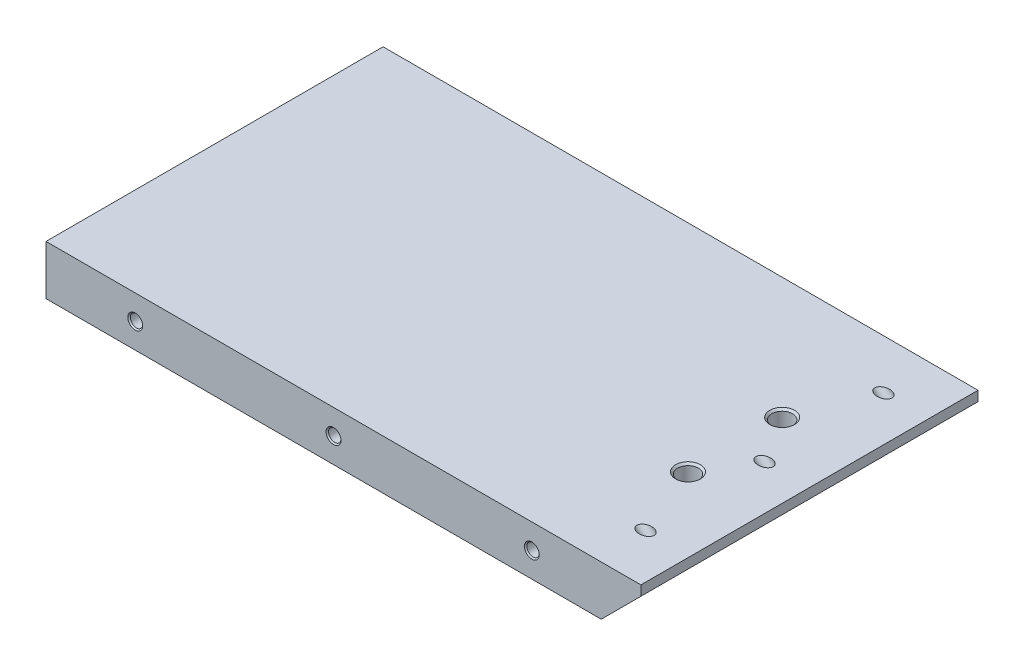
SolidWorks part; units mm, degrees
ref_plane "Face" through (0, 0, 0) normal (0, 0, 1) x (1, 0, 0)
ref_plane "Dessus" through (0, 0, 0) normal (0, 1, 0) x (1, 0, 0)
ref_plane "Profil" through (0, 0, 0) normal (1, 0, 0) x (0, 0, -1)
sketch "Esquisse1" plane through (0, 0, 0) normal (0, 0, 1) x (1, 0, 0)
  line L1 (0, -5) -> (120, -5)
  line L2 (0, -5) -> (0, 5)
  line L3 (0, 5) -> (120, 5)
  line L4 (120, -5) -> (120, 5)
  point P4 (0, 0)
  dimension "D1" = 120
  dimension "D2" = 10
extrude "Extrusion1" add sketch "Esquisse1" along normal mid plane 68
chamfer "Chanfrein1" distance 8 angle 45 1 edges at (120, -5, 0)
hole_wizard "Trou taraudé M5x0.81" positions "Esquisse3" profile "Esquisse2" tap size "M5x0.8" standard "ISO"
sketch "Esquisse3" plane through (0, 0, 0) normal (-1, 0, 0) x (0, 0, 1)
  line L0 (50, 0) -> (-50, 0) construction
  point P0 (-29, 0)
  dimension "D1" = 29
sketch "Esquisse2" plane through (0, 0, -29) normal (0, 1, 0) x (0, 0, 1)
  line L0 (0, 0) -> (0, 16.2618)
  line L1 (0, 16.2618) -> (2.1, 15)
  line L2 (2.1, 15) -> (2.1, 0.4)
  line L3 (2.1, 0.4) -> (2.5, 0)
  line L5 (2.5, 0) -> (0, 0)
  line L6 (-2.1, 0.4) -> (-2.5, 0) construction
  line L10 (0, 16.2618) -> (-2.1, 15) construction
  line L11 (0, -6.35) -> (0, 107.95) construction
  dimension "Diamètre du trou pour taraudage" = 4.2
  dimension "Profondeur du trou pour taraudage" = 15
  dimension "Diamètre du fraisage entrant" = 5
  dimension "Angle du fraisage entrant" = 90
  dimension "Angle de pointe" = 118
pattern_linear "Répétition linéaire1" count 2 spacing 58 along (0, 0, 1) of "Trou taraudé M5x0.81"
hole_wizard "Diamètre du perçage M5.0 (5.000000)1" positions "Esquisse5" profile "Esquisse6" hole size "M5.0" standard "ISO"
sketch "Esquisse5" plane through (0, 0, 0) normal (-1, 0, 0) x (0, 0, 1)
  line L0 (50, 0) -> (-50, 0) construction
  point P0 (-22.5, 0)
  dimension "D1" = 22.5
sketch "Esquisse6" plane through (0, 0, -22.5) normal (0, 1, 0) x (0, 0, 1)
  line L0 (0, 0) -> (0, 13.5022)
  line L1 (0, 13.5022) -> (2.5, 12)
  line L2 (2.5, 12) -> (2.5, 0.5)
  line L3 (2.5, 0.5) -> (3, 0)
  line L5 (3, 0) -> (0, 0)
  line L6 (-2.5, 0.5) -> (-3, 0) construction
  line L10 (0, 13.5022) -> (-2.5, 12) construction
  line L11 (0, -6.35) -> (0, 107.95) construction
  dimension "Diamètre du perçage" = 5
  dimension "Profondeur du perçage" = 12
  dimension "Diamètre du fraisage entrant" = 6
  dimension "Angle du fraisage entrant" = 90
  dimension "Angle de pointe" = 118
pattern_linear "Répétition linéaire2" count 2 spacing 45 along (0, 0, 1) of "Diamètre du perçage M5.0 (5.000000)1"
hole_wizard "Trou taraudé M5x0.82" positions "Esquisse3D1" profile "Esquisse7" tap size "M5x0.8" standard "ISO"
sketch3d "Esquisse3D1"
  point P0 (105, 5, 9.5)
  dimension "D1" = 9.5
  dimension "D2" = 105
sketch "Esquisse7" plane through (105, 5, 9.5) normal (1, 0, 0) x (0, 0, 1)
  line L0 (0, 0) -> (0, 10)
  line L1 (0, 10) -> (2.1, 10)
  line L2 (2.1, 10) -> (2.1, 0.4)
  line L3 (2.1, 0.4) -> (2.5, 0)
  line L5 (2.5, 0) -> (0, 0)
  line L6 (-2.1, 0.4) -> (-2.5, 0) construction
  line L11 (0, -6.35) -> (0, 107.95) construction
  dimension "Diamètre du trou pour taraudage jusqu'au prochain" = 4.2
  dimension "Profondeur du trou pour taraudage jusqu'au prochain" = 10
  dimension "Diamètre du fraisage entrant" = 5
  dimension "Angle du fraisage entrant" = 90
pattern_linear "Répétition linéaire3" count 2 spacing 19 along (0, 0, -1) of "Trou taraudé M5x0.82"
hole_wizard "Trou taraudé M3x0.51" positions "Esquisse9" profile "Esquisse8" tap size "M3x0.5" standard "ISO"
sketch "Esquisse9" plane through (58.5, -58.5, 0) normal (0.7071, -0.7071, 0) x (0.7071, 0.7071, 0)
  line L0 (75.6604, 34) -> (86.9741, 34) construction
  line L1 (86.9741, 34) -> (86.9741, -34) construction
  point P0 (81.9741, 24)
  dimension "D1" = 10
  dimension "D2" = 5
sketch "Esquisse8" plane through (116.4645, -0.5355, 24) normal (0, 0, 1) x (0.7071, 0.7071, 0)
  line L0 (0, 0) -> (0, 86.267)
  line L1 (0, 86.267) -> (1.25, 86.267)
  line L2 (1.25, 86.267) -> (1.25, 0.75)
  line L3 (1.25, 0.75) -> (2, 0)
  line L5 (2, 0) -> (0, 0)
  line L6 (-1.25, 0.75) -> (-2, 0) construction
  line L11 (0, -6.35) -> (0, 107.95) construction
  dimension "Diamètre du trou pour taraudage jusqu'au prochain" = 2.5
  dimension "Profondeur du trou pour taraudage jusqu'au prochain" = 86.267
  dimension "Diamètre du fraisage entrant" = 4
  dimension "Angle du fraisage entrant" = 90
pattern_linear "Répétition linéaire4" count 3 spacing 24 along (0, 0, -1) of "Trou taraudé M3x0.51"
hole_wizard "Trou taraudé M3x0.52" positions "Esquisse3D2" profile "Esquisse10" tap size "M3x0.5" standard "ISO"
sketch3d "Esquisse3D2"
  line L0 (0, 5, 34) -> (0, -5, 34) construction
  point P0 (18, 0, 34)
  dimension "D1" = 18
sketch "Esquisse10" plane through (18, 0, 34) normal (1, 0, 0) x (0, -1, 0)
  line L0 (0, 0) -> (0, 10.7511)
  line L1 (0, 10.7511) -> (1.25, 10)
  line L2 (1.25, 10) -> (1.25, 0.25)
  line L3 (1.25, 0.25) -> (1.5, 0)
  line L5 (1.5, 0) -> (0, 0)
  line L6 (-1.25, 0.25) -> (-1.5, 0) construction
  line L10 (0, 10.7511) -> (-1.25, 10) construction
  line L11 (0, -6.35) -> (0, 107.95) construction
  dimension "Diamètre du trou pour taraudage" = 2.5
  dimension "Profondeur du trou pour taraudage" = 10
  dimension "Diamètre du fraisage entrant" = 3
  dimension "Angle du fraisage entrant" = 90
  dimension "Angle de pointe" = 118
pattern_linear "Répétition linéaire5" count 3 spacing 40 along (1, 0, 0) of "Trou taraudé M3x0.52"
hole_wizard "Trou taraudé M3x0.53" positions "Esquisse12" profile "Esquisse11" tap size "M3x0.5" standard "ISO"
sketch "Esquisse12" plane through (0, 0, -34) normal (0, 0, -1) x (-1, 0, 0)
  line L0 (0, 5) -> (0, -5) construction
  line L1 (50, 0) -> (-50, 0) construction
  point P0 (-18, 0)
  dimension "D1" = 18
sketch "Esquisse11" plane through (18, 0, -34) normal (1, 0, 0) x (0, 1, 0)
  line L0 (0, 0) -> (0, 10.7511)
  line L1 (0, 10.7511) -> (1.25, 10)
  line L2 (1.25, 10) -> (1.25, 0.25)
  line L3 (1.25, 0.25) -> (1.5, 0)
  line L5 (1.5, 0) -> (0, 0)
  line L6 (-1.25, 0.25) -> (-1.5, 0) construction
  line L10 (0, 10.7511) -> (-1.25, 10) construction
  line L11 (0, -6.35) -> (0, 107.95) construction
  dimension "Diamètre du trou pour taraudage" = 2.5
  dimension "Profondeur du trou pour taraudage" = 10
  dimension "Diamètre du fraisage entrant" = 3
  dimension "Angle du fraisage entrant" = 90
  dimension "Angle de pointe" = 118
pattern_linear "Répétition linéaire6" count 3 spacing 40 along (1, 0, 0) of "Trou taraudé M3x0.53"
